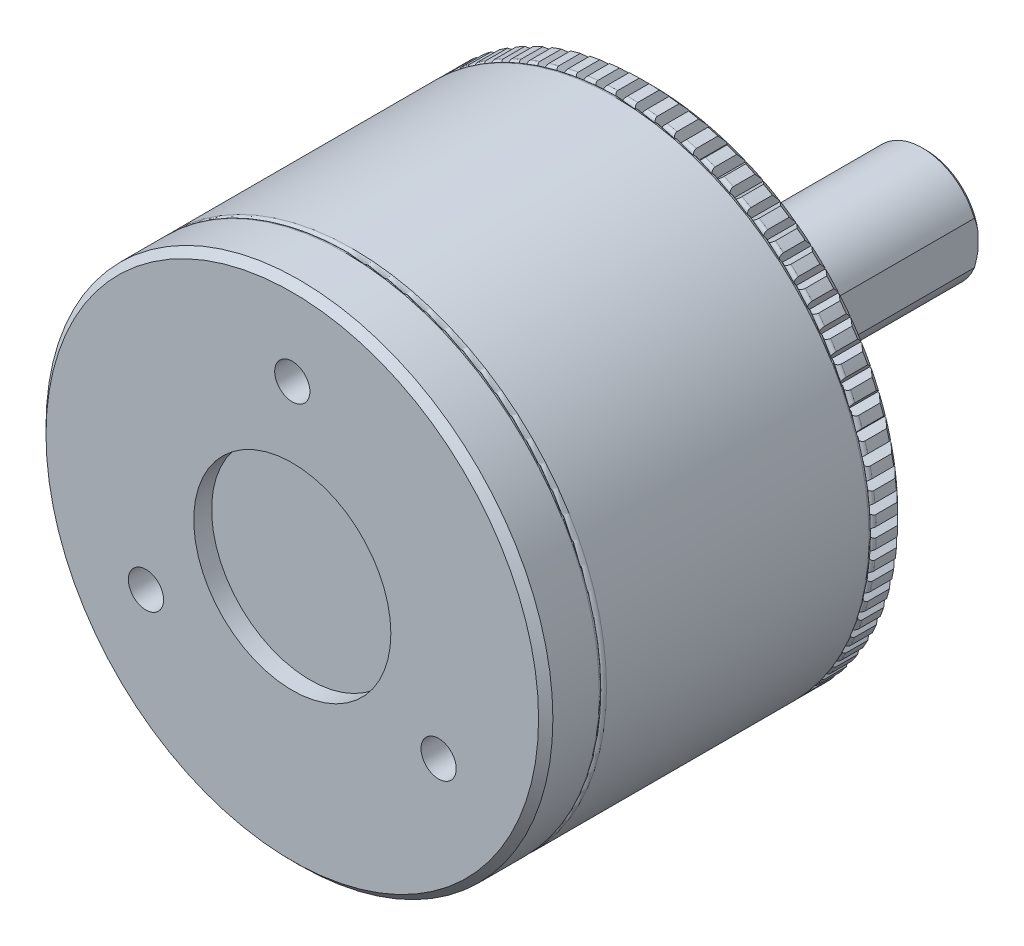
SolidWorks part; units mm, degrees
ref_plane "Front Plane" through (0, 0, 0) normal (0, 0, 1) x (1, 0, 0)
ref_plane "Top Plane" through (0, 0, 0) normal (0, 1, 0) x (1, 0, 0)
ref_plane "Right Plane" through (0, 0, 0) normal (1, 0, 0) x (0, 0, -1)
sketch "Sketch1" plane through (0, 0, 0) normal (1, 0, 0) x (0, 0, -1)
  line L0 (0, 7) -> (0, 17.492)
  line L1 (55, 0) -> (-55, 0) construction
  line L2 (23.464, 18) -> (24.992, 18)
  line L3 (25.5, 17.492) -> (25.5, 7)
  line L4 (24.23, 4) -> (44.746, 4)
  line L5 (45, 3.746) -> (45, 0)
  line L6 (45, 0) -> (1.27, 0)
  line L7 (1.27, 0) -> (1.27, 7)
  line L8 (1.27, 7) -> (0, 7)
  line L9 (-61.5609, 0) -> (59.5214, 0) construction
  line L10 (0, 55) -> (0, -55) construction
  line L11 (0, 17.492) -> (0.508, 18)
  line L12 (24.992, 18) -> (25.5, 17.492)
  line L13 (44.746, 4) -> (45, 3.746)
  line L14 (25.5, 7) -> (24.23, 7)
  line L15 (24.23, 7) -> (24.23, 4)
  line L16 (23.21, 17.746) -> (23.21, 17.5)
  line L17 (0.508, 18) -> (3.806, 18)
  line L18 (23.2099, 17.746) -> (23.2099, 17.5)
  line L19 (23.2099, 17.5) -> (23.21, 17.5)
  line L20 (4.06, 17.746) -> (4.06, 17.5)
  line L21 (4.061, 17.746) -> (4.061, 17.5)
  line L22 (4.315, 18) -> (22.9559, 18)
  line L23 (4.06, 17.5) -> (4.061, 17.5)
  arc A0 (23.21, 17.746) -> (23.464, 18) centre (23.464, 17.746) cw
  arc A1 (22.9559, 18) -> (23.2099, 17.746) centre (22.9559, 17.746) cw
  arc A2 (4.061, 17.746) -> (4.315, 18) centre (4.315, 17.746) cw
  arc A3 (4.06, 17.746) -> (3.806, 18) centre (3.806, 17.746) ccw
  point P1 (0, 18)
  point P5 (25.5, 18)
  point P7 (45, 4)
  point P37 (4.061, 18)
  dimension "D8" = 0.254
  dimension "D9" = 0.254
  dimension "D15" = 0.254
  dimension "D1" = 25.5
  dimension "D2" = 45
  dimension "D3" = 1.27
  dimension "D4" = 1.27
  dimension "D5" = 14
  dimension "D6" = 36
  dimension "D7" = 8
  dimension "D13" = 0.0001
  dimension "D14" = 2.29
  dimension "D16" = 0.001
  dimension "D17" = 4.06
  dimension "D18" = 0.5
revolve "Revolve1" add sketch "Sketch1" angle 360 about L9
hole_wizard "M3x0.5 Tapped Hole1" positions "Sketch3" profile "Sketch2" tap size "M3x0.5" standard "Ansi Metric"
sketch "Sketch3" plane through (0, 0, -25.5) normal (0, 0, -1) x (-1, 0, 0)
  line L0 (0, 0) -> (0, 12) construction
  line L3 (0, 0) -> (10.3923, -6) construction
  line L6 (0, 0) -> (-10.3923, -6) construction
  circle A0 centre (0, 0) radius 12
  point P0 (0, 12)
  point P1 (10.3923, -6)
  point P3 (-10.3923, -6)
  dimension "D1" = 24
  dimension "D2" = 120
  dimension "D3" = 120
sketch "Sketch2" plane through (0, 12, -25.5) normal (1, 0, 0) x (0, 1, 0)
  line L0 (0, 0) -> (0, 7.7511)
  line L1 (0, 7.7511) -> (1.25, 7)
  line L2 (1.25, 7) -> (1.25, 0)
  line L5 (1.25, 0) -> (0, 0)
  line L10 (0, 7.7511) -> (-1.25, 7) construction
  line L11 (0, -6.35) -> (0, 107.95) construction
  dimension "Tap Drill Dia." = 2.5
  dimension "Tap Drill Depth" = 7
  dimension "Drill Angle" = 118
ref_plane "Plane1" through (0, 0, -12.75) normal (0, 0, -1) x (-1, 0, 0)
mirror "Mirror1" about plane through (0, 0, -12.75) normal (0, 0, -1) of "M3x0.5 Tapped Hole1"
sketch "Sketch4" plane through (0, 0, -25.5) normal (0, 0, -1) x (-1, 0, 0)
  line L0 (-0.508, 18.2799) -> (0.508, 18.2799)
  line L1 (0, 17.4) -> (0.508, 18.2799)
  line L3 (-0.508, 18.2799) -> (0, 17.4)
  line L4 (0, 0) -> (0, 18) construction
  line L6 (0.4399, 18.162) -> (-0.4399, 18.162)
  circle A0 centre (0, 0) radius 18 construction
  dimension "D1" = 1.016
  dimension "D3" = 17.4
extrude "Cut-Extrude1" cut sketch "Sketch4" against normal blind 2.29
pattern_circular "CirPattern1" count 80 over 360 about axis through (0, 0, 0) along (0, 0, 1) of "Cut-Extrude1"
sketch "Sketch6" plane through (0, 0, -45) normal (0, 0, -1) x (-1, 0, 0)
  line L0 (0, 0) -> (-3.746, 0) construction
  line L1 (-4.7, 2.5) -> (-3.7, 2.5)
  line L2 (-4.7, 2.5) -> (-4.7, -2.5)
  line L3 (-4.7, -2.5) -> (-3.7, -2.5)
  line L4 (-3.7, 2.5) -> (-3.7, -2.5)
  circle A0 centre (0, 0) radius 3.746 construction
  circle A7 centre (0, 0) radius 4 construction
  dimension "D1" = 7.7
  dimension "D2" = 5
  dimension "D3" = 1
extrude "Cut-Extrude3" cut sketch "Sketch6" against normal up to surface (19.5 mm away)
